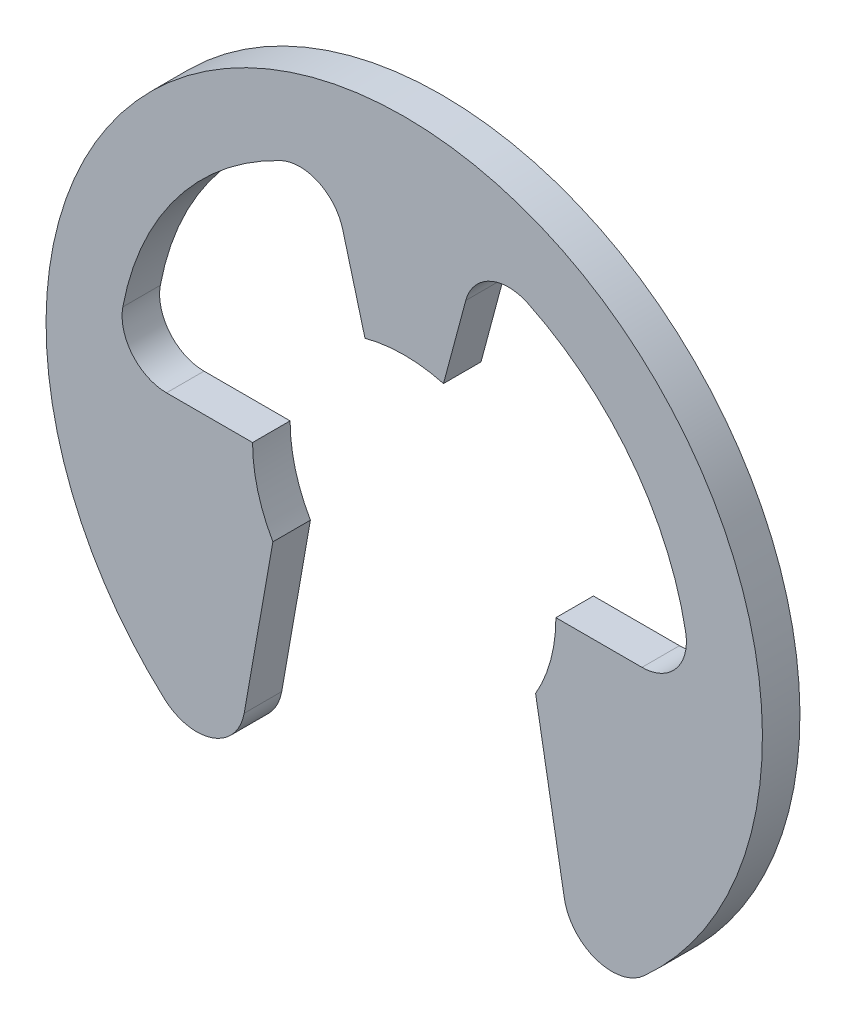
SolidWorks part; units mm, degrees
ref_plane "Plane1" through (0, 0, 0) normal (0, 0, 1) x (1, 0, 0)
ref_plane "Plane2" through (0, 0, 0) normal (0, 1, 0) x (1, 0, 0)
ref_plane "Plane3" through (0, 0, 0) normal (1, 0, 0) x (0, 0, -1)
extrude "Body" add sketch "BodySke" against normal blind 0.6
sketch "BodySke" plane through (0, 0, 0) normal (0, 0, 1) x (1, 0, 0)
  line L0 (-0.7581, 0) -> (0.7581, 0) construction
  line L1 (0, 0) -> (0, 2.425) construction
  line L2 (0, 0) -> (0.1962, 0.7323) construction
  line L3 (0, 0) -> (2.1001, -1.2125) construction
  line L4 (0, 0) -> (-0.1962, 0.7323) construction
  line L5 (0, 0) -> (-2.1001, -1.2125) construction
  line L6 (2.1001, -1.2125) -> (2.5592, -3.8161)
  line L7 (-2.1001, -1.2125) -> (-2.5592, -3.8161)
  line L9 (2.425, 0) -> (3.8011, 0)
  line L10 (-2.425, 0) -> (-3.8011, 0)
  line L11 (0.6276, 2.3424) -> (0.9838, 3.6716)
  line L12 (-0.6276, 2.3424) -> (-0.9838, 3.6716)
  circle A0 centre (0, 0) radius 2.425 construction
  arc A1 (4.4993, 0.8406) -> (1.9765, 4.1284) centre (0, 0) ccw
  arc A2 (3.8338, -4.2547) -> (-3.8338, -4.2547) centre (0, 0) ccw
  arc A3 (2.1001, -1.2125) -> (2.425, 0) centre (0, 0) ccw
  arc A4 (-1.9765, 4.1284) -> (-4.4993, 0.8406) centre (0, 0) ccw
  arc A5 (-2.425, 0) -> (-2.1001, -1.2125) centre (0, 0) ccw
  arc A6 (-0.6276, 2.3424) -> (0.6276, 2.3424) centre (0, 0) cw
  arc A7 (1.9765, 4.1284) -> (0.9838, 3.6716) centre (1.6698, 3.4878) ccw
  arc A8 (2.5592, -3.8161) -> (3.8338, -4.2547) centre (3.318, -3.6823) ccw
  arc A9 (-3.8338, -4.2547) -> (-2.5592, -3.8161) centre (-3.318, -3.6823) ccw
  arc A10 (-4.4993, 0.8406) -> (-3.8011, 0) centre (-3.8011, 0.7102) ccw
  arc A11 (-0.9838, 3.6716) -> (-1.9765, 4.1284) centre (-1.6698, 3.4878) ccw
  arc A12 (3.8011, 0) -> (4.4993, 0.8406) centre (3.8011, 0.7102) ccw
  dimension "D1" = 30
  dimension "GrooveDia" = 4.85
  dimension "OutsideDia" = 11.4543
  dimension "D3" = 30
  dimension "TipRad" = 0.7705
  dimension "CavityDia" = 9.1543
  dimension "CavityFilletRad" = 0.7102
  dimension "D4" = 20
sketch "Clipboard" plane through (0, 0, 0) normal (0, 0, 1) x (1, 0, 0)
  line L0 (0, 0) -> (1.15, 0)
  circle A0 centre (0, 0) radius 2.35
  circle A1 centre (0, 0) radius 5.55
  dimension "FreeID" = 4.7
  dimension "FreeOD" = 11.1
  dimension "Bridge" = 1.15
equation "' \"FreeID@Clipboard\" = 0.64"
equation "' \"Thickness@Body\" = 0.25"
equation "' \"GrooveDia@BodySke\" = 0.72"
equation "' \"FreeOD@Clipboard\" = 2"
equation "' \"Bridge@Clipboard\" = 0.3"
equation "' \"FreeID@Clipboard\" = 19.5"
equation "' \"Thickness@Body\" = 1.3"
equation "' \"GrooveDia@BodySke\" = 20.00"
equation "' \"FreeOD@Clipboard\" = 37.1"
equation "' \"Bridge@Clipboard\" = 3.3"
equation "\"OutsideDia@BodySke\" = ( \"GrooveDia@BodySke\"  /  \"FreeID@Clipboard\" )  * \"FreeOD@Clipboard\""
equation "\"CavityDia@BodySke\" = \"OutsideDia@BodySke\"  - 2 * \"Bridge@Clipboard\""
equation "\"CavityFilletRad@BodySke\" =  (\"CavityDia@BodySke\" - \"GrooveDia@BodySke\") / 2 * 0.33"
equation "\"TipRad@BodySke\" = 0.67 * \"Bridge@Clipboard\""
